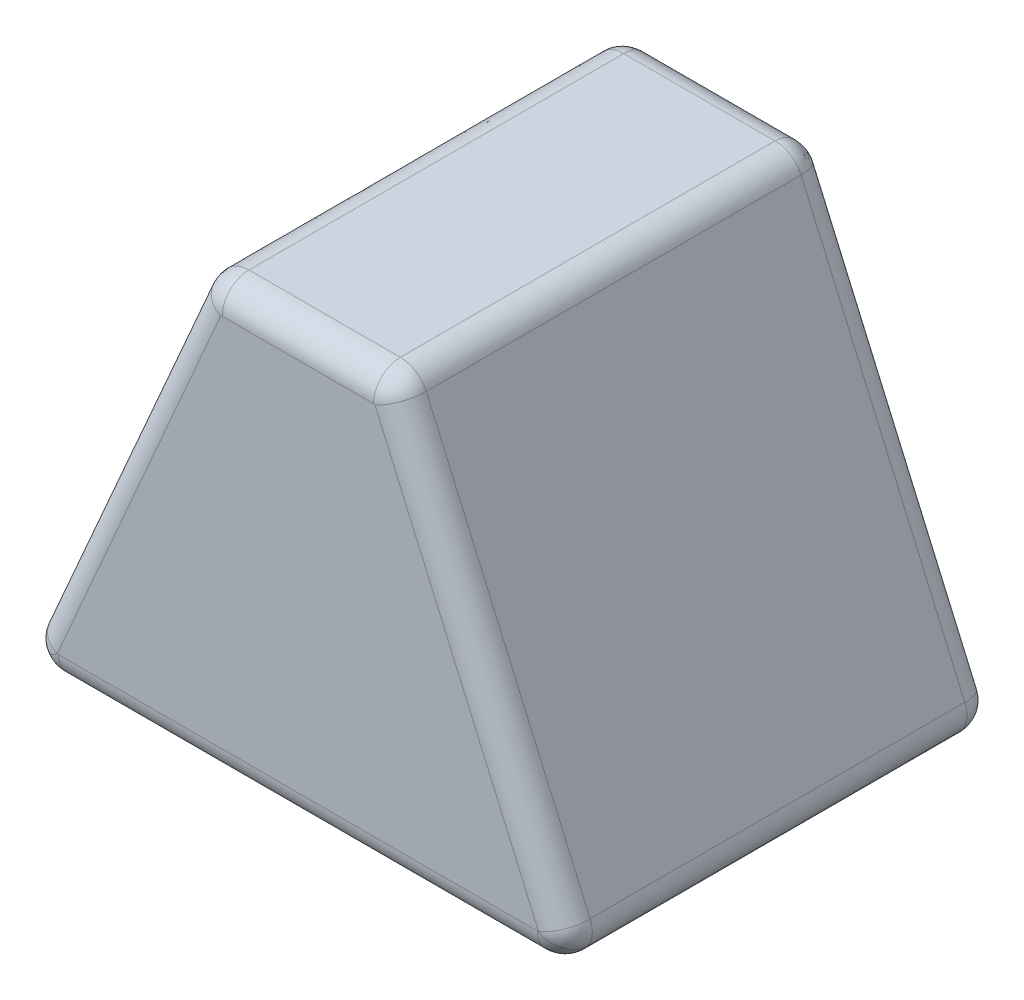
SolidWorks part; units mm, degrees
ref_plane "Front Plane" through (0, 0, 0) normal (0, 0, 1) x (1, 0, 0)
ref_plane "Top Plane" through (0, 0, 0) normal (0, 1, 0) x (1, 0, 0)
ref_plane "Right Plane" through (0, 0, 0) normal (1, 0, 0) x (0, 0, -1)
sketch "Sketch1" plane through (0, 0, 0) normal (0, 0, 1) x (1, 0, 0)
  line L0 (-128.0697, 122.5056) -> (-116.7662, 122.5056)
  line L1 (-114.823, 121.2728) -> (-102.5861, 93.2728)
  line L2 (-104.5292, 90.5056) -> (-140.3068, 90.5056)
  line L3 (-142.2499, 93.2729) -> (-130.0129, 121.2729)
  spline S0 degree 3 poles (-116.7662, 122.5056) (-115.8977, 122.5056) (-115.1562, 122.0351) (-114.823, 121.2728) knots 0.1 0.1 0.1 0.1 0.2 0.2 0.2 0.2
  spline S1 degree 3 poles (-102.5861, 93.2728) (-102.3081, 92.6367) (-102.3768, 91.9682) (-102.7791, 91.3953) knots 0.3 0.3 0.3 0.3 0.4 0.4 0.4 0.4
  spline S2 degree 3 poles (-102.7791, 91.3953) (-103.1814, 90.8224) (-103.8046, 90.5056) (-104.5292, 90.5056) knots 0.4 0.4 0.4 0.4 0.5 0.5 0.5 0.5
  spline S3 degree 3 poles (-140.3068, 90.5056) (-141.0314, 90.5056) (-141.6546, 90.8224) (-142.0569, 91.3954) knots 0.6 0.6 0.6 0.6 0.7 0.7 0.7 0.7
  spline S4 degree 3 poles (-142.0569, 91.3954) (-142.4592, 91.9683) (-142.528, 92.6368) (-142.2499, 93.2729) knots 0.7 0.7 0.7 0.7 0.8 0.8 0.8 0.8
  spline S5 degree 3 poles (-130.0129, 121.2729) (-129.6797, 122.0352) (-128.9382, 122.5056) (-128.0697, 122.5056) knots 0.9 0.9 0.9 0.9 1 1 1 1
extrude "Boss-Extrude1" add sketch "Sketch1" along normal blind 32
fillet "Fillet1" radius 2 20 edges at (-136.1314, 107.2729, 0) (-122.418, 90.5056, 0) (-108.7045, 107.2728, 0) (-122.4179, 122.5056, 0) (-122.4179, 122.5056, 32) (-108.7045, 107.2728, 32) (-122.418, 90.5056, 32) (-136.1314, 107.2729, 32)
